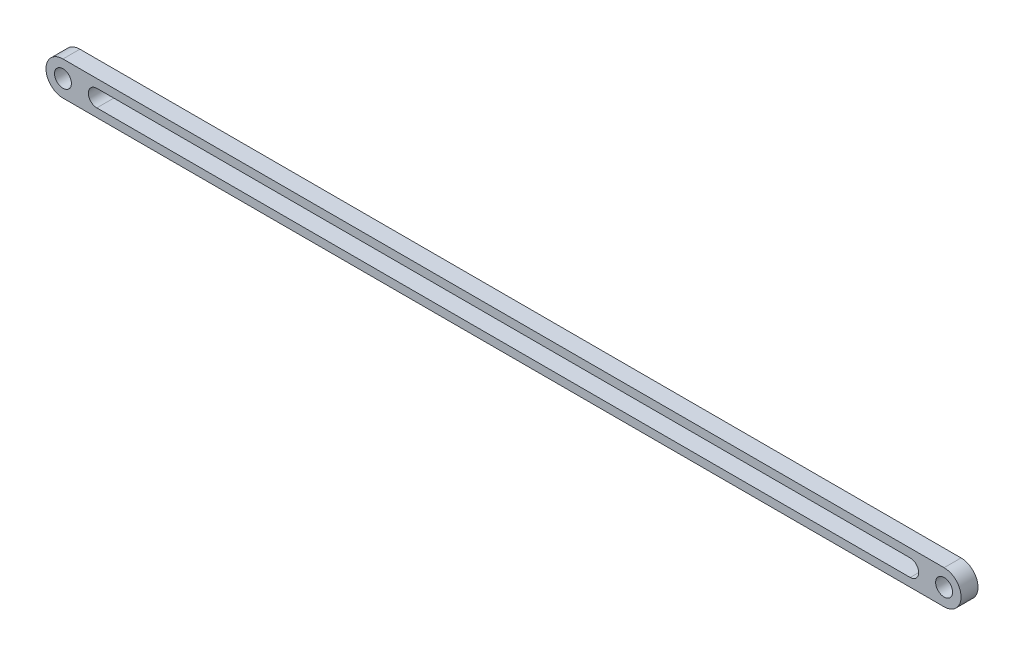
SolidWorks part; units mm, degrees
ref_plane "Front Plane" through (0, 0, 0) normal (0, 0, 1) x (1, 0, 0)
ref_plane "Top Plane" through (0, 0, 0) normal (0, 1, 0) x (1, 0, 0)
ref_plane "Right Plane" through (0, 0, 0) normal (1, 0, 0) x (0, 0, -1)
sketch "Sketch1" plane through (0, 0, 0) normal (0, 0, 1) x (1, 0, 0)
  line L0 (0, 0) -> (165.1, 0) construction
  line L1 (0, 3.175) -> (165.1, 3.175)
  line L2 (0, -3.175) -> (165.1, -3.175)
  line L3 (6.35, 0) -> (158.75, 0) construction
  line L4 (6.35, 1.5875) -> (158.75, 1.5875)
  line L5 (6.35, -1.5875) -> (158.75, -1.5875)
  arc A0 (0, 3.175) -> (0, -3.175) centre (0, 0) ccw
  arc A1 (165.1, -3.175) -> (165.1, 3.175) centre (165.1, 0) ccw
  circle A2 centre (0, 0) radius 1.5875
  circle A3 centre (165.1, 0) radius 1.5875
  arc A5 (6.35, 1.5875) -> (6.35, -1.5875) centre (6.35, 0) ccw
  arc A6 (158.75, -1.5875) -> (158.75, 1.5875) centre (158.75, 0) ccw
  point P3 (82.55, 0)
  point P14 (82.55, 0)
  point P19 (0, 0)
extrude "Boss-Extrude1" add sketch "Sketch1" along normal blind 3.175
equation "\"D5@Sketch1\"=\"D3@Sketch1\"-0.5in"
